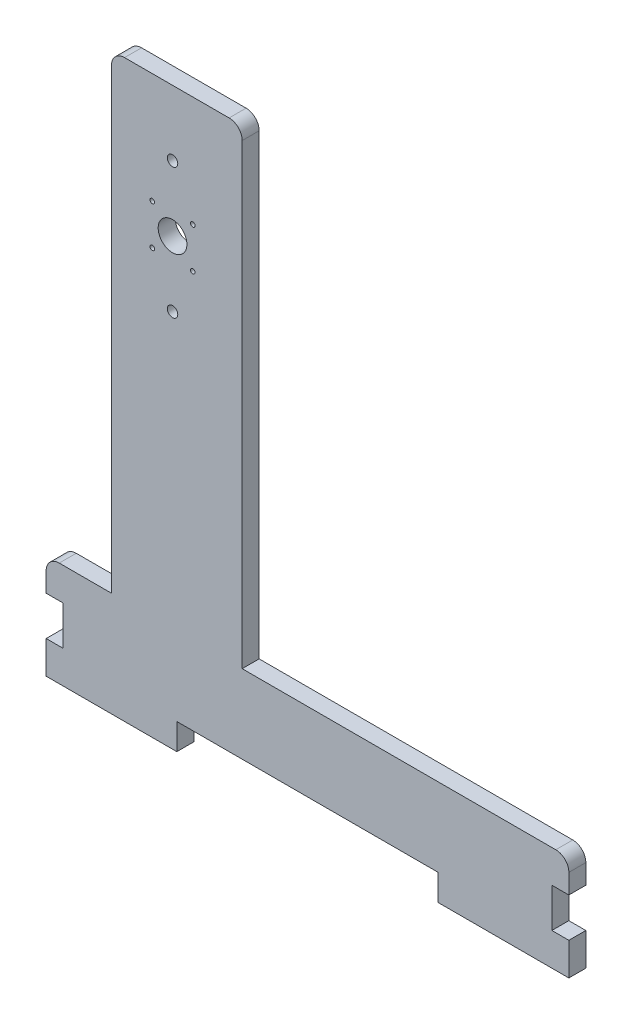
SolidWorks part; units mm, degrees
ref_plane "Alzado" through (0, 0, 0) normal (0, 0, 1) x (1, 0, 0)
ref_plane "Planta" through (0, 0, 0) normal (0, 1, 0) x (1, 0, 0)
ref_plane "Vista lateral" through (0, 0, 0) normal (1, 0, 0) x (0, 0, -1)
sketch "Croquis1" plane through (0, 0, 0) normal (0, 0, 1) x (1, 0, 0)
  line L0 (100, -40) -> (200, -40)
  line L1 (-200, -40) -> (-100, -40)
  line L2 (-200, -40) -> (-200, 40)
  line L3 (-200, 40) -> (-150, 40)
  line L4 (200, -40) -> (200, 40)
  line L5 (-100, -20) -> (100, -20)
  line L6 (-50, 40) -> (200, 40)
  line L8 (-100, -40) -> (-100, -20)
  line L10 (100, -40) -> (100, -20)
  line L12 (-150, 40) -> (-150, 400)
  line L13 (-150, 400) -> (-50, 400)
  line L14 (-50, 40) -> (-50, 400)
  point P0 (0, 0)
  dimension "D1" = 400
  dimension "D2" = 80
  dimension "D3" = 100
  dimension "D4" = 100
  dimension "D5" = 60
  dimension "D6" = 360
  dimension "D7" = 50
  dimension "D8" = 250
extrude "Saliente-Extruir1" add sketch "Croquis1" along normal blind 13
fillet "Redondeo3" radius 10 1 edges at (-150, 400, 6.5)
fillet "Redondeo4" radius 10 1 edges at (-50, 400, 6.5)
fillet "Redondeo5" radius 10 1 edges at (200, 40, 6.5)
fillet "Redondeo6" radius 10 1 edges at (-200, 40, 6.5)
sketch "Croquis2" plane through (0, 0, 13) normal (0, 0, 1) x (1, 0, 0)
  line L0 (200, -40) -> (200, 30) construction
  line L9 (200, 15) -> (187, 15)
  line L10 (200, 15) -> (200, -15)
  line L11 (200, -15) -> (187, -15)
  line L12 (187, 15) -> (187, -15)
  line L15 (0, 0) -> (0, 51.529) construction
  line L16 (-200, 15) -> (-200, -15)
  line L17 (-200, -15) -> (-187, -15)
  line L18 (-187, 15) -> (-187, -15)
  line L19 (-200, 15) -> (-187, 15)
  line L21 (-103.2868, 350) -> (-103.2868, 346) construction
  line L22 (-50, 40) -> (-50, 390) construction
  line L23 (-150, 40) -> (-190, 40) construction
  line L24 (-60, 400) -> (-140, 400) construction
  line L34 (-103.2868, 254) -> (-103.2868, 250) construction
  circle A10 centre (-103.2868, 350) radius 4
  circle A12 centre (-103.2868, 300) radius 11
  circle A13 centre (-103.2868, 250) radius 4
  circle A16 centre (-118.7868, 315.5) radius 1.75
  circle A17 centre (-87.7868, 315.5) radius 1.75
  circle A18 centre (-87.7868, 284.5) radius 1.75
  circle A19 centre (-118.7868, 284.5) radius 1.75
  dimension "D3" = 31
  dimension "D11" = 3.5
  dimension "D12" = 25
  dimension "D13" = 8
  dimension "D14" = 22
  dimension "D5" = 31
  dimension "D17" = 8
  dimension "D6" = 3.5
  dimension "D9" = 3.5
  dimension "D10" = 3.5
  dimension "D15" = 13
  dimension "D16" = 30
  dimension "D18" = 50
  dimension "D20" = 50
  dimension "D21" = 50
  dimension "D22" = 53.2868
extrude "Cortar-Extruir1" cut sketch "Croquis2" against normal blind 13
